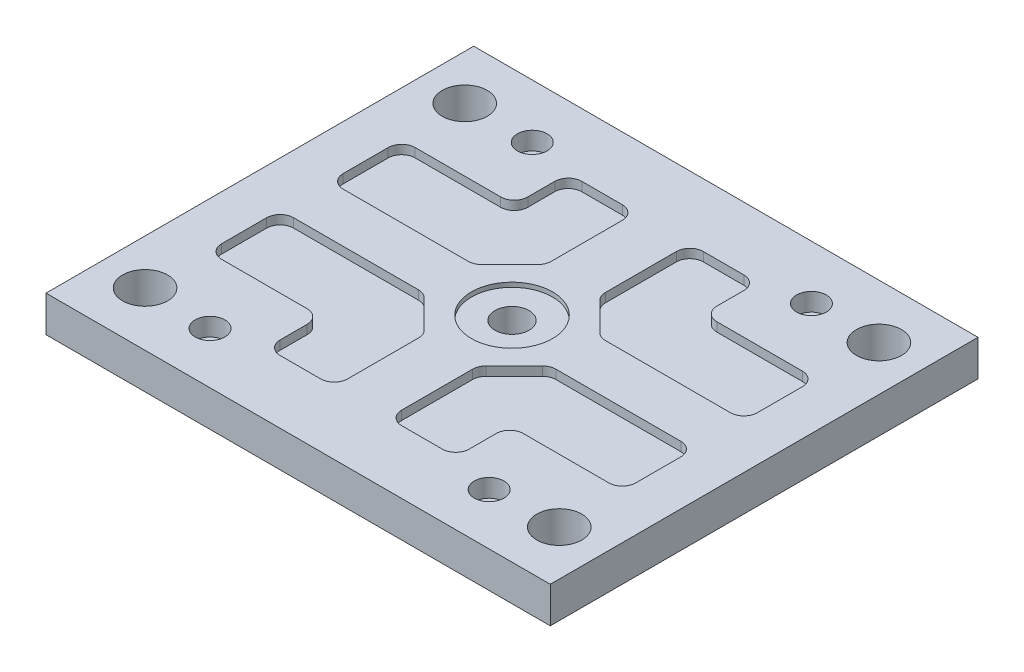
SolidWorks part; units mm, degrees
ref_plane "Front" through (0, 0, 0) normal (0, 0, 1) x (1, 0, 0)
ref_plane "Top" through (0, 0, 0) normal (0, 1, 0) x (1, 0, 0)
ref_plane "Right" through (0, 0, 0) normal (1, 0, 0) x (0, 0, -1)
sketch "Sketch1" plane through (0, 0, 0) normal (0, 1, 0) x (1, 0, 0)
  line L1 (-280, -237.5) -> (280, -237.5)
  line L2 (-280, -237.5) -> (-280, 237.5)
  line L3 (-280, 237.5) -> (280, 237.5)
  line L4 (280, -237.5) -> (280, 237.5)
  line L5 (-280, -237.5) -> (280, 237.5) construction
  line L6 (-280, 237.5) -> (280, -237.5) construction
  point P0 (0, 0)
  dimension "D1" = 560
  dimension "D2" = 475
extrude "Boss-Extrude1" add sketch "Sketch1" along normal blind 40
sketch "Sketch2" plane through (0, 40, 0) normal (0, 1, 0) x (1, 0, 0)
  line L0 (-230, 177.5) -> (-230, -177.5) construction
  line L1 (-230, -177.5) -> (230, -177.5) construction
  line L2 (230, -177.5) -> (230, 177.5) construction
  line L3 (230, 177.5) -> (-230, 177.5) construction
  line L4 (-280, 237.5) -> (-280, -237.5) construction
  line L5 (280, -237.5) -> (280, 237.5) construction
  line L6 (280, 237.5) -> (-280, 237.5) construction
  line L7 (-280, -237.5) -> (280, -237.5) construction
  circle A0 centre (-230, 177.5) radius 25
  circle A1 centre (230, 177.5) radius 25
  circle A2 centre (-230, -177.5) radius 25
  circle A3 centre (230, -177.5) radius 25
  dimension "D5" = 50
  dimension "D1" = 50
  dimension "D2" = 50
  dimension "D3" = 60
  dimension "D4" = 60
extrude "Cut-Extrude1" cut sketch "Sketch2" against normal through all
hole_wizard "CBORE for M20 SHCS1" positions "Sketch3" profile "Sketch4" counterbore size "M20" standard "ANSI Metric"
sketch "Sketch3" plane through (0, 40, 0) normal (0, 1, 0) x (-1, 0, 0)
  line L0 (280, -237.5) -> (280, 237.5) construction
  line L1 (-280, 237.5) -> (-280, -237.5) construction
  line L2 (155, -177.5) -> (155, 180.3673) construction
  line L3 (155, 180.3673) -> (-155, 180.3673) construction
  line L5 (155, -177.5) -> (-155, -177.5) construction
  line L6 (-155, -177.5) -> (-155, 180.3673) construction
  point P0 (155, -177.5)
  point P2 (-155, -177.5)
  point P4 (-155, 180.3673)
  point P6 (155, 180.3673)
  dimension "D1" = 125
  dimension "D2" = 125
sketch "Sketch4" plane through (-155, 40, -177.5) normal (1, 0, 0) x (0, 0, 1)
  line L0 (0, 0) -> (0, 40)
  line L1 (0, 40) -> (11, 40)
  line L3 (11, 40) -> (11, 20)
  line L4 (11, 20) -> (16.5, 20)
  line L5 (16.5, 20) -> (16.5, 0)
  line L7 (16.5, 0) -> (0, 0)
  line L11 (0, -6.35) -> (0, 107.95) construction
  dimension "Thru Hole Dia." = 22
  dimension "Thru Hole Depth" = 40
  dimension "C'Bore Dia." = 33
  dimension "C'Bore Depth" = 20
sketch "Sketch5" plane through (0, 40, 0) normal (0, 1, 0) x (1, 0, 0)
  circle A0 centre (0, 0) radius 45
  dimension "D1" = 90
extrude "Cut-Extrude2" cut sketch "Sketch5" against normal blind 5
sketch "Sketch6" plane through (0, 35, 0) normal (0, 1, 0) x (1, 0, 0)
  circle A0 centre (0, 0) radius 19
  dimension "D1" = 38
extrude "Cut-Extrude3" cut sketch "Sketch6" against normal through all
sketch "Sketch7" plane through (0, 40, 0) normal (0, 1, 0) x (1, 0, 0)
  line L0 (0, 237.5) -> (0, -237.5) construction
  line L1 (280, 237.5) -> (-280, 237.5) construction
  line L2 (-280, -237.5) -> (280, -237.5) construction
  line L3 (-280, 0) -> (280, 0) construction
  line L4 (-280, 237.5) -> (-280, -237.5) construction
  line L5 (280, -237.5) -> (280, 237.5) construction
  line L6 (-30, -152.5) -> (-30, -73.7132)
  line L7 (-34.3934, -63.1066) -> (-65.6066, -31.8934)
  line L8 (-76.2132, -27.5) -> (-215, -27.5)
  line L9 (-230, -42.5) -> (-230, -92.5)
  line L10 (-215, -107.5) -> (-120, -107.5)
  line L11 (-105, -122.5) -> (-105, -152.5)
  line L12 (-90, -167.5) -> (-45, -167.5)
  line L13 (-105, 122.5) -> (-105, 152.5)
  line L14 (-215, 107.5) -> (-120, 107.5)
  line L15 (-230, 42.5) -> (-230, 92.5)
  line L16 (-76.2132, 27.5) -> (-215, 27.5)
  line L17 (-34.3934, 63.1066) -> (-65.6066, 31.8934)
  line L18 (-30, 152.5) -> (-30, 73.7132)
  line L19 (-90, 167.5) -> (-45, 167.5)
  line L20 (215, 107.5) -> (120, 107.5)
  line L21 (230, 42.5) -> (230, 92.5)
  line L22 (76.2132, 27.5) -> (215, 27.5)
  line L23 (34.3934, 63.1066) -> (65.6066, 31.8934)
  line L24 (30, 152.5) -> (30, 73.7132)
  line L25 (90, 167.5) -> (45, 167.5)
  line L26 (105, 122.5) -> (105, 152.5)
  line L27 (105, -122.5) -> (105, -152.5)
  line L28 (215, -107.5) -> (120, -107.5)
  line L29 (230, -42.5) -> (230, -92.5)
  line L30 (76.2132, -27.5) -> (215, -27.5)
  line L31 (34.3934, -63.1066) -> (65.6066, -31.8934)
  line L32 (30, -152.5) -> (30, -73.7132)
  line L33 (90, -167.5) -> (45, -167.5)
  arc A0 (-120, -107.5) -> (-105, -122.5) centre (-120, -122.5) cw
  arc A1 (-105, -152.5) -> (-90, -167.5) centre (-90, -152.5) ccw
  arc A2 (-30, -152.5) -> (-45, -167.5) centre (-45, -152.5) cw
  arc A3 (-30, -73.7132) -> (-34.3934, -63.1066) centre (-45, -73.7132) ccw
  arc A4 (-65.6066, -31.8934) -> (-76.2132, -27.5) centre (-76.2132, -42.5) ccw
  arc A5 (-215, -27.5) -> (-230, -42.5) centre (-215, -42.5) ccw
  arc A6 (-230, -92.5) -> (-215, -107.5) centre (-215, -92.5) ccw
  arc A7 (-120, 107.5) -> (-105, 122.5) centre (-120, 122.5) ccw
  arc A8 (-230, 92.5) -> (-215, 107.5) centre (-215, 92.5) cw
  arc A9 (-215, 27.5) -> (-230, 42.5) centre (-215, 42.5) cw
  arc A10 (-65.6066, 31.8934) -> (-76.2132, 27.5) centre (-76.2132, 42.5) cw
  arc A11 (-30, 73.7132) -> (-34.3934, 63.1066) centre (-45, 73.7132) cw
  arc A12 (-105, 152.5) -> (-90, 167.5) centre (-90, 152.5) cw
  arc A13 (-30, 152.5) -> (-45, 167.5) centre (-45, 152.5) ccw
  arc A14 (120, 107.5) -> (105, 122.5) centre (120, 122.5) cw
  arc A15 (230, 92.5) -> (215, 107.5) centre (215, 92.5) ccw
  arc A16 (215, 27.5) -> (230, 42.5) centre (215, 42.5) ccw
  arc A17 (65.6066, 31.8934) -> (76.2132, 27.5) centre (76.2132, 42.5) ccw
  arc A18 (30, 73.7132) -> (34.3934, 63.1066) centre (45, 73.7132) ccw
  arc A19 (30, 152.5) -> (45, 167.5) centre (45, 152.5) cw
  arc A20 (105, 152.5) -> (90, 167.5) centre (90, 152.5) ccw
  arc A21 (120, -107.5) -> (105, -122.5) centre (120, -122.5) ccw
  arc A22 (230, -92.5) -> (215, -107.5) centre (215, -92.5) cw
  arc A23 (215, -27.5) -> (230, -42.5) centre (215, -42.5) cw
  arc A24 (65.6066, -31.8934) -> (76.2132, -27.5) centre (76.2132, -42.5) cw
  arc A25 (30, -73.7132) -> (34.3934, -63.1066) centre (45, -73.7132) cw
  arc A26 (105, -152.5) -> (90, -167.5) centre (90, -152.5) cw
  arc A27 (30, -152.5) -> (45, -167.5) centre (45, -152.5) ccw
  point P21 (-105, -107.5)
  point P24 (-105, -167.5)
  point P27 (-30, -167.5)
  point P30 (-30, -67.5)
  point P35 (-230, -27.5)
  point P38 (-230, -107.5)
  dimension "D9" = 15
  dimension "D1" = 30
  dimension "D2" = 50
  dimension "D3" = 75
  dimension "D4" = 80
  dimension "D5" = 210
  dimension "D6" = 60
  dimension "D7" = 135
  dimension "D8" = 100
extrude "Cut-Extrude4" cut sketch "Sketch7" against normal blind 10
sketch "Sketch8" plane through (0, 0, 0) normal (0, -1, 0) x (1, 0, 0)
  line L0 (0, 237.5) -> (0, -237.5) construction
  line L1 (-280, 0) -> (280, 0) construction
  line L2 (-30, -152.5) -> (-30, -73.7132)
  line L3 (-34.3934, -63.1066) -> (-65.6066, -31.8934)
  line L4 (-76.2132, -27.5) -> (-215, -27.5)
  line L5 (-230, -42.5) -> (-230, -92.5)
  line L6 (-215, -107.5) -> (-120, -107.5)
  line L7 (-105, -122.5) -> (-105, -152.5)
  line L8 (-90, -167.5) -> (-45, -167.5)
  line L9 (-105, 122.5) -> (-105, 152.5)
  line L10 (-215, 107.5) -> (-120, 107.5)
  line L11 (-230, 42.5) -> (-230, 92.5)
  line L12 (-76.2132, 27.5) -> (-215, 27.5)
  line L13 (-34.3934, 63.1066) -> (-65.6066, 31.8934)
  line L14 (-30, 152.5) -> (-30, 73.7132)
  line L15 (-90, 167.5) -> (-45, 167.5)
  line L16 (215, 107.5) -> (120, 107.5)
  line L17 (230, 42.5) -> (230, 92.5)
  line L18 (76.2132, 27.5) -> (215, 27.5)
  line L19 (34.3934, 63.1066) -> (65.6066, 31.8934)
  line L20 (30, 152.5) -> (30, 73.7132)
  line L21 (90, 167.5) -> (45, 167.5)
  line L22 (105, 122.5) -> (105, 152.5)
  line L23 (105, -122.5) -> (105, -152.5)
  line L24 (215, -107.5) -> (120, -107.5)
  line L25 (230, -42.5) -> (230, -92.5)
  line L26 (76.2132, -27.5) -> (215, -27.5)
  line L27 (34.3934, -63.1066) -> (65.6066, -31.8934)
  line L28 (30, -152.5) -> (30, -73.7132)
  line L29 (90, -167.5) -> (45, -167.5)
  arc A0 (-120, -107.5) -> (-105, -122.5) centre (-120, -122.5) cw
  arc A1 (-105, -152.5) -> (-90, -167.5) centre (-90, -152.5) ccw
  arc A2 (-30, -152.5) -> (-45, -167.5) centre (-45, -152.5) cw
  arc A3 (-30, -73.7132) -> (-34.3934, -63.1066) centre (-45, -73.7132) ccw
  arc A4 (-65.6066, -31.8934) -> (-76.2132, -27.5) centre (-76.2132, -42.5) ccw
  arc A5 (-215, -27.5) -> (-230, -42.5) centre (-215, -42.5) ccw
  arc A6 (-230, -92.5) -> (-215, -107.5) centre (-215, -92.5) ccw
  arc A7 (-120, 107.5) -> (-105, 122.5) centre (-120, 122.5) ccw
  arc A8 (-230, 92.5) -> (-215, 107.5) centre (-215, 92.5) cw
  arc A9 (-215, 27.5) -> (-230, 42.5) centre (-215, 42.5) cw
  arc A10 (-65.6066, 31.8934) -> (-76.2132, 27.5) centre (-76.2132, 42.5) cw
  arc A11 (-30, 73.7132) -> (-34.3934, 63.1066) centre (-45, 73.7132) cw
  arc A12 (-105, 152.5) -> (-90, 167.5) centre (-90, 152.5) cw
  arc A13 (-30, 152.5) -> (-45, 167.5) centre (-45, 152.5) ccw
  arc A14 (120, 107.5) -> (105, 122.5) centre (120, 122.5) cw
  arc A15 (230, 92.5) -> (215, 107.5) centre (215, 92.5) ccw
  arc A16 (215, 27.5) -> (230, 42.5) centre (215, 42.5) ccw
  arc A17 (65.6066, 31.8934) -> (76.2132, 27.5) centre (76.2132, 42.5) ccw
  arc A18 (30, 73.7132) -> (34.3934, 63.1066) centre (45, 73.7132) ccw
  arc A19 (30, 152.5) -> (45, 167.5) centre (45, 152.5) cw
  arc A20 (105, 152.5) -> (90, 167.5) centre (90, 152.5) ccw
  arc A21 (120, -107.5) -> (105, -122.5) centre (120, -122.5) ccw
  arc A22 (230, -92.5) -> (215, -107.5) centre (215, -92.5) cw
  arc A23 (215, -27.5) -> (230, -42.5) centre (215, -42.5) cw
  arc A24 (65.6066, -31.8934) -> (76.2132, -27.5) centre (76.2132, -42.5) cw
  arc A25 (30, -73.7132) -> (34.3934, -63.1066) centre (45, -73.7132) cw
  arc A26 (105, -152.5) -> (90, -167.5) centre (90, -152.5) cw
  arc A27 (30, -152.5) -> (45, -167.5) centre (45, -152.5) ccw
extrude "Cut-Extrude5" cut sketch "Sketch8" against normal blind 10
